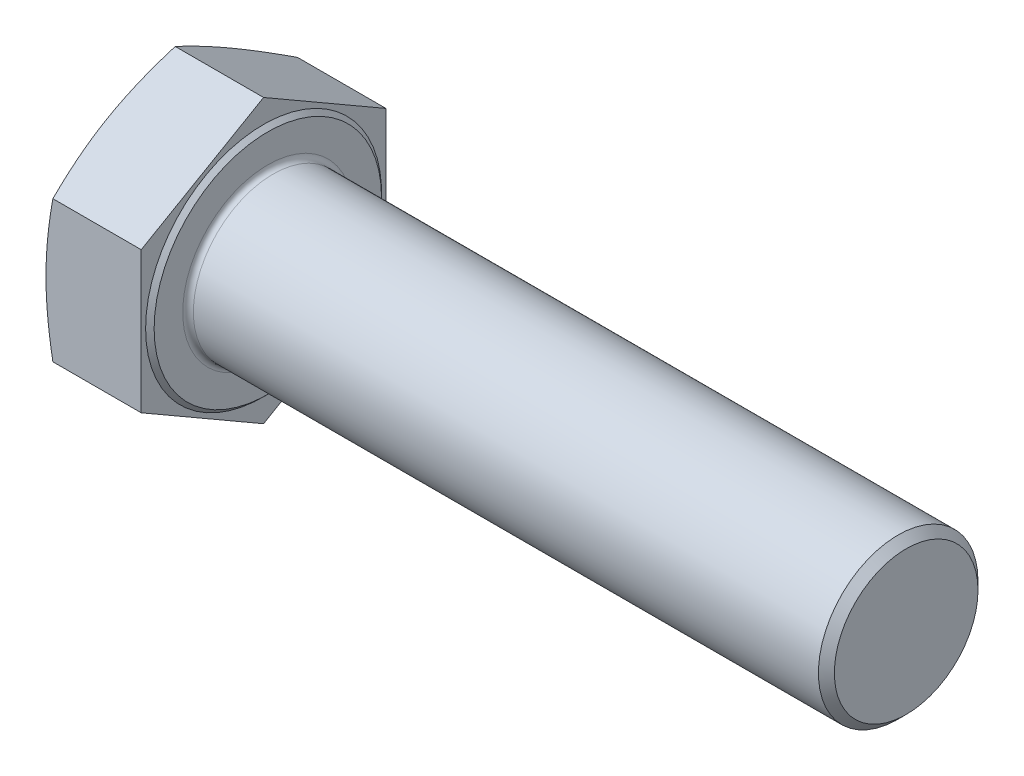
SolidWorks part; units mm, degrees
ref_plane "Front" through (0, 0, 0) normal (0, 0, 1) x (1, 0, 0)
ref_plane "Top" through (0, 0, 0) normal (0, 1, 0) x (1, 0, 0)
ref_plane "Right" through (0, 0, 0) normal (1, 0, 0) x (0, 0, -1)
sketch "Sketch2" plane through (0, 0, 0) normal (1, 0, 0) x (0, 0, -1)
  line L1 (0, -26.5581) -> (23, -13.2791)
  line L2 (23, -13.2791) -> (23, 13.2791)
  line L3 (23, 13.2791) -> (0, 26.5581)
  line L4 (0, 26.5581) -> (-23, 13.2791)
  line L5 (-23, 13.2791) -> (-23, -13.2791)
  line L6 (-23, -13.2791) -> (0, -26.5581)
  circle A0 centre (0, 0) radius 23 construction
  dimension "s" = 46
extrude "BaseHead" add sketch "Sketch2" along normal blind 18.7
sketch "Sketch3" plane through (0, 0, 0) normal (0, 0, 1) x (1, 0, 0)
  line L0 (18.7, 26.5581) -> (18.7, 21.375)
  line L2 (18.7, 21.375) -> (17.9, 22.175)
  line L3 (17.9, 22.175) -> (17.9, 26.5581)
  line L5 (17.9, 26.5581) -> (18.7, 26.5581)
  line L6 (-0.9571, 0) -> (7.6478, 0) construction
  line L7 (18.7, 26.5581) -> (0, 26.5581) construction
  dimension "D1" = 45
  dimension "c" = 0.8
  dimension "dw" = 42.75
revolve "BearingFace" cut sketch "Sketch3" angle 360 about L6
sketch "Sketch4" plane through (0, 0, 0) normal (0, 0, 1) x (1, 0, 0)
  line L0 (-0.4935, 0) -> (3.5626, 0) construction
  line L2 (0, 26.5581) -> (1.295, 26.5581)
  line L4 (1.295, 26.5581) -> (0, 23)
  line L6 (0, 23) -> (0, 26.5581)
  line L7 (17.9, 26.5581) -> (0, 26.5581) construction
  dimension "D1" = 20
  dimension "D2" = 46
revolve "HeadChamfer" cut sketch "Sketch4" angle 360 about L0
ref_plane "Plane1" through (72.7, 0, 0) normal (1, 0, 0) x (0, 0, -1)
sketch "Sketch5" plane through (18.7, 0, 0) normal (1, 0, 0) x (0, 0, -1)
  circle A0 centre (0, 0) radius 15
  dimension "d" = 30
extrude "BaseBody" add sketch "Sketch5" along normal blind 120
chamfer "Chamfer1" distance 1.5 angle 45 1 edges at (138.7, 0, -15)
fillet "HeadFillet" radius 1 1 edges at (18.7, 0, -15)
equation "\"D2@Sketch4\" = \"s@Sketch2\""
equation "\"D1@Chamfer1\" = 0.05 * \"d@Sketch5\""
equation "\"D1@ThreadCosmetic1\" = \"l@BaseBody\" - \"lg@Plane1\""
